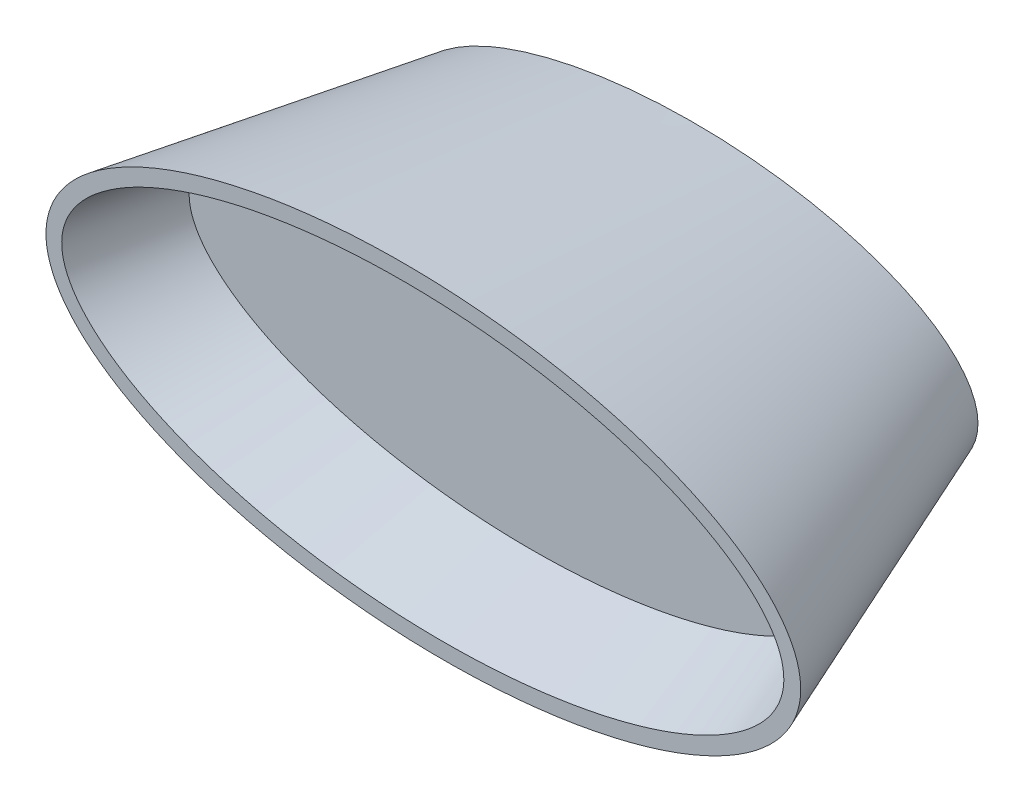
SolidWorks part; units mm, degrees
ref_plane "Ebene vorne" through (0, 0, 0) normal (0, 0, 1) x (1, 0, 0)
ref_plane "Ebene oben" through (0, 0, 0) normal (0, 1, 0) x (1, 0, 0)
ref_plane "Ebene rechts" through (0, 0, 0) normal (1, 0, 0) x (0, 0, -1)
sketch "Skizze1" plane through (0, 0, 0) normal (0, 0, 1) x (1, 0, 0)
  ellipse E0 centre (0, 0) end of major axis (-91.559, 0) minor radius 38.1912
ref_plane "Ebene1" through (0, 0, 100) normal (0, 0, 1) x (1, 0, 0)
sketch "Skizze2" plane through (0, 0, 100) normal (0, 0, 1) x (1, 0, 0)
  ellipse E0 centre (12.7433, 0) end of major axis (134.3874, -3.3974) minor radius 52.0949
loft "Ausformung1" add profiles "Skizze2", "Skizze1"
shell "Wandung1" thickness 5
ref_plane "Ebene2" through (0, 0, 65) normal (0, 0, 1) x (1, 0, 0)
surface "Oberfläche-Zusammenfügen1"
sketch "Skizze3" plane through (0, 0, 65) normal (0, 0, 1) x (1, 0, 0)
  spline S0 degree 3 number of poles 70 (-68.1872, 30.0716) -> (-68.1872, 30.0716) construction
  spline S1 degree 3 number of poles 70 (-68.1872, 30.0716) -> (-68.1872, 30.0716)
extrude "Linear austragen2" add sketch "Skizze3" against normal up to surface separate body
equation "\"LÄNGE\"=0"
equation "\"BREITE\"=0"
equation "\"HÖHE\"=0"
equation "\"DURCHMESSER\"=0"
equation "\"Stückzahl\"= 1"
